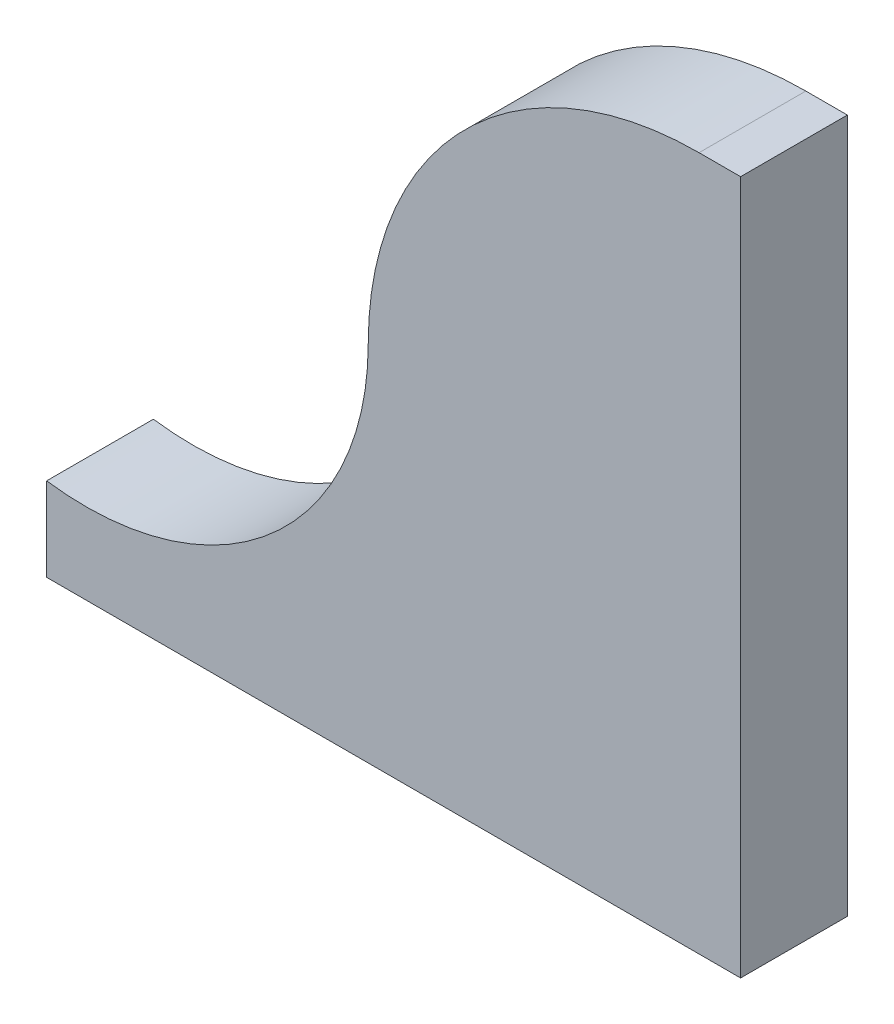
SolidWorks part; units mm, degrees
ref_plane "前视基准面" through (0, 0, 0) normal (0, 0, 1) x (1, 0, 0)
ref_plane "上视基准面" through (0, 0, 0) normal (0, 1, 0) x (1, 0, 0)
ref_plane "右视基准面" through (0, 0, 0) normal (1, 0, 0) x (0, 0, -1)
sketch "Sketch1" plane through (0, 0, 0) normal (0, 0, 1) x (1, 0, 0)
  line L0 (-65, 0) -> (0, 0)
  line L1 (0, 0) -> (0, 65)
  line L2 (-65, 0) -> (-65, 7.8273)
  line L3 (0, 65) -> (-3.8919, 65)
  arc A0 (-65, 7.8273) -> (-34.8773, 34.0146) centre (-61.3217, 34.0146) ccw
  arc A1 (-3.8919, 65) -> (-34.8773, 34.0146) centre (-3.8919, 34.0146) ccw
  dimension "D1" = 65
  dimension "D2" = 65
extrude "Extrude1" add sketch "Sketch1" along normal blind 10
